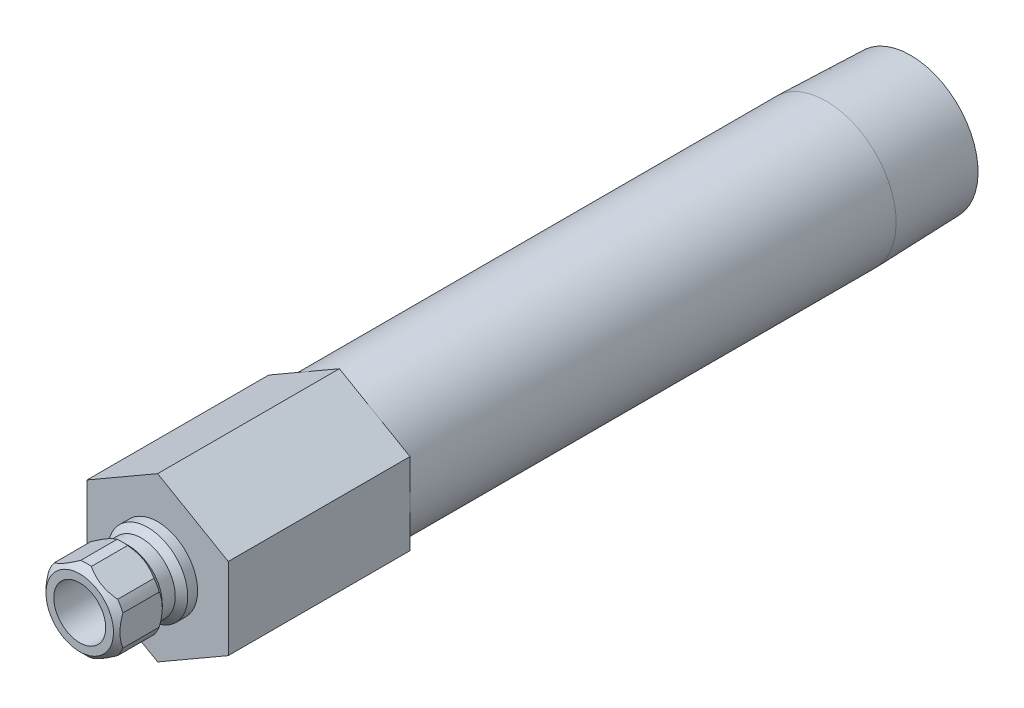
SolidWorks part; units mm, degrees
ref_plane "Front Plane" through (0, 0, 0) normal (0, 0, 1) x (1, 0, 0)
ref_plane "Top Plane" through (0, 0, 0) normal (0, 1, 0) x (1, 0, 0)
ref_plane "Right Plane" through (0, 0, 0) normal (1, 0, 0) x (0, 0, -1)
sketch "Sketch1" plane through (0, 0, 0) normal (1, 0, 0) x (0, 0, -1)
  line L0 (0, 0) -> (-12.7, 0) construction
  line L1 (-9.525, 3.175) -> (-9.525, 4.1275)
  line L2 (-3.556, 4.1275) -> (-3.556, 0) construction
  line L3 (-8.763, 4.8895) -> (-4.318, 4.8895)
  line L4 (0, 8.5725) -> (0, 0) construction
  line L5 (-3.556, 4.1275) -> (-1.9685, 4.1275)
  line L6 (-1.2065, 4.8895) -> (0, 4.8895)
  line L7 (0, 4.8895) -> (0, 8.5725)
  line L8 (-3.556, 4.1275) -> (-4.318, 4.8895)
  line L9 (-1.9685, 4.1275) -> (-1.2065, 4.8895)
  line L10 (-9.525, 4.1275) -> (-8.763, 4.8895)
  line L11 (-9.525, 3.175) -> (22.225, 3.175)
  line L12 (0, 8.5725) -> (81.7372, 8.5725)
  line L13 (81.7372, 8.5725) -> (92.075, 8.2494)
  line L14 (92.075, 8.2494) -> (92.075, 6.2611)
  line L15 (0, 0) -> (22.225, 0) construction
  line L16 (22.225, 0) -> (22.225, 3.175) construction
  line L17 (22.225, 4.8895) -> (0, 4.8895) construction
  line L18 (22.225, 3.175) -> (22.225, 6.2611)
  line L19 (22.225, 6.2611) -> (92.075, 6.2611)
  line L20 (22.225, 3.175) -> (22.225, 4.8895) construction
  dimension "D1" = 9.525
  dimension "D2" = 1.5875
  dimension "D3" = 0.762
  dimension "D4" = 45
  dimension "D5" = 5.969
  dimension "D6" = 45
  dimension "D7" = 1.79
  dimension "D8" = 10.3378
  dimension "D9" = 101.6
  dimension "D10" = 3.175
  dimension "D11" = 31.75
  dimension "D12" = 6.35
  dimension "D13" = 12.5222
  dimension "D14" = 9.779
  dimension "D15" = 17.145
revolve "Revolve1" add sketch "Sketch1" angle 360 about L0
sketch "Sketch2" plane through (0, 0, 0) normal (0, 0, 1) x (1, 0, 0)
  line L1 (-8.636, 4.986) -> (-8.636, -4.986)
  line L2 (-8.636, -4.986) -> (0, -9.972)
  line L3 (0, -9.972) -> (8.636, -4.986)
  line L4 (8.636, -4.986) -> (8.636, 4.986)
  line L5 (8.636, 4.986) -> (0, 9.972)
  line L6 (0, 9.972) -> (-8.636, 4.986)
  circle A0 centre (0, 0) radius 8.636 construction
  circle A1 centre (0, 0) radius 3.175 construction
  circle A2 centre (0, 0) radius 3.175
  dimension "D1" = 17.272
extrude "Boss-Extrude1" add sketch "Sketch2" against normal up to vertex (22.225 mm away) from vertex at 0
sketch "Sketch3" plane through (0, 0, 0) normal (0, 0, 1) x (1, 0, 0)
  line L1 (4.5212, 2.6103) -> (0, 5.2206)
  line L2 (0, 5.2206) -> (-4.5212, 2.6103)
  line L3 (-4.5212, 2.6103) -> (-4.5212, -2.6103)
  line L4 (-4.5212, -2.6103) -> (0, -5.2206)
  line L5 (0, -5.2206) -> (4.5212, -2.6103)
  line L6 (4.5212, -2.6103) -> (4.5212, 2.6103)
  circle A0 centre (0, 0) radius 4.5212 construction
  dimension "D1" = 9.0424
extrude "Cut-Extrude1" cut sketch "Sketch3" along normal through all from vertex at 3.556 flip side to cut
